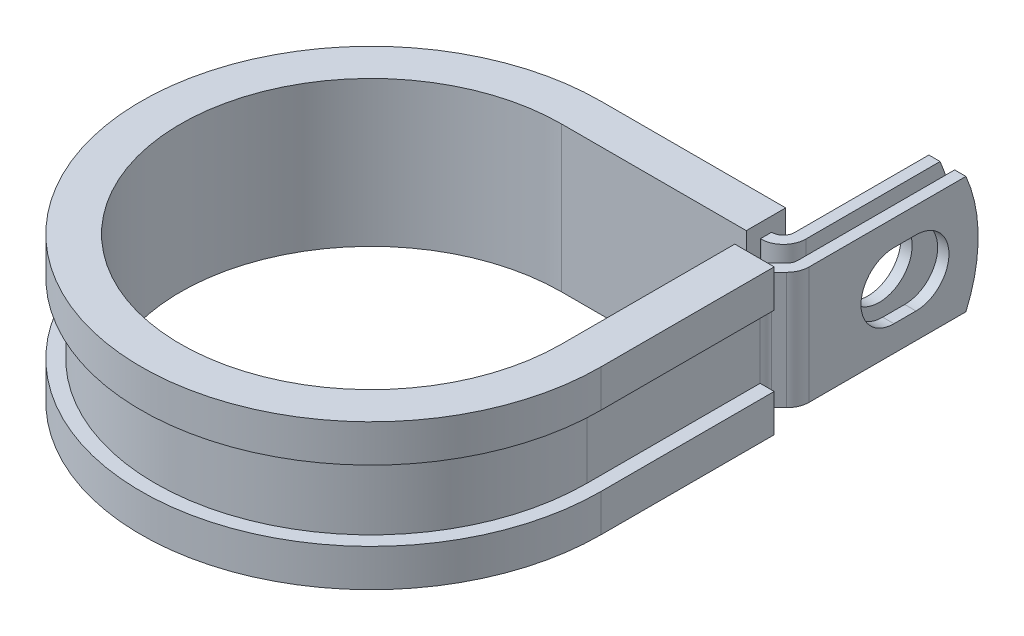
SolidWorks part; units mm, degrees
ref_plane "Front Plane" through (0, 0, 0) normal (0, 0, 1) x (1, 0, 0)
ref_plane "Top Plane" through (0, 0, 0) normal (0, 1, 0) x (1, 0, 0)
ref_plane "Right Plane" through (0, 0, 0) normal (1, 0, 0) x (0, 0, -1)
sketch "Sketch1" plane through (0, 0, 0) normal (0, 1, 0) x (1, 0, 0)
  line L0 (0, 22.1615) -> (20.0458, 22.1615)
  line L1 (22.1615, 0) -> (22.1615, 18.749)
  line L2 (22.4842, 40.4622) -> (22.4842, 24.5999)
  line L3 (22.8757, 20.4732) -> (23.7019, 21.2994)
  line L5 (24.059, 22.1615) -> (24.059, 40.4622)
  arc A0 (0, 22.1615) -> (22.1615, 0) centre (0, 0) ccw
  arc A1 (22.8757, 20.4732) -> (22.1615, 18.749) centre (24.5999, 18.749) ccw
  arc A2 (23.7019, 21.2994) -> (24.059, 22.1615) centre (22.8398, 22.1615) ccw
  arc A3 (20.0458, 22.1615) -> (22.4842, 24.5999) centre (20.0458, 24.5999) ccw
extrude "Extrude-Thin1" add sketch "Sketch1" along normal mid plane 12.7 thin
sketch "Sketch2" plane through (21.265, 0, 0) normal (-1, 0, 0) x (0, 0, 1)
  line L0 (-40.4622, 6.35) -> (-40.4622, -6.35) construction
  line L1 (0, 6.35) -> (0, -6.35) construction
  circle A0 centre (-32.5374, 0) radius 3.5687
  point P2 (-40.4622, 0)
extrude "Cut-Extrude1" cut sketch "Sketch2" against normal up to surface (1.2192 mm away)
sketch "Sketch3" plane through (25.2782, 0, 0) normal (1, 0, 0) x (0, 0, -1)
  line L0 (31.3436, 0) -> (33.7312, 0) construction
  line L1 (31.3436, 3.5687) -> (33.7312, 3.5687)
  line L2 (31.3436, -3.5687) -> (33.7312, -3.5687)
  line L3 (40.4622, 6.35) -> (40.4622, -6.35) construction
  arc A0 (31.3436, 3.5687) -> (31.3436, -3.5687) centre (31.3436, 0) ccw
  arc A1 (33.7312, -3.5687) -> (33.7312, 3.5687) centre (33.7312, 0) ccw
  point P3 (32.5374, 0)
  point P8 (40.4622, 0)
  point P11 (27.7749, 0)
  point P12 (37.2999, 0)
extrude "Cut-Extrude2" cut sketch "Sketch3" against normal up to surface (1.2192 mm away)
sketch "Sketch4" plane through (21.265, 0, 0) normal (-1, 0, 0) x (0, 0, 1)
  line L0 (-40.4622, 6.35) -> (-40.4622, -6.35)
  line L1 (-40.4622, 6.35) -> (-39.1369, 6.35)
  line L2 (-40.4622, 6.35) -> (-24.5999, 6.35) construction
  line L3 (-40.4622, -6.35) -> (-39.1369, -6.35)
  line L4 (-40.4622, -6.35) -> (-24.5999, -6.35) construction
  arc A0 (-39.1369, 6.35) -> (-39.1369, -6.35) centre (-24.5872, 0) ccw
extrude "Cut-Extrude3" cut sketch "Sketch4" against normal through all contours A0 M4 M5 | A0 L0 M2
ref_plane "Plane1" through (0, 0, -18.749) normal (0, 0, -1) x (-1, 0, 0)
ref_plane "Plane2" through (19.995, 0, 0) normal (-1, 0, 0) x (0, 0, 1)
sketch "Sketch5" plane through (0, 0, -18.749) normal (0, 0, -1) x (-1, 0, 0)
  line L0 (-23.3807, 6.35) -> (-22.1615, 6.35)
  line L1 (-23.3807, 6.35) -> (-23.3807, -6.35) construction
  line L3 (-22.1615, 6.35) -> (-22.1615, -6.35)
  line L4 (-22.1615, -6.35) -> (-23.3807, -6.35)
  line L5 (-23.3807, -6.35) -> (-23.3807, -3.81)
  line L6 (-23.3807, 6.35) -> (-23.3807, 3.81)
  line L7 (-24.9047, 7.874) -> (-24.9047, 3.81)
  line L8 (-24.9047, 7.874) -> (-20.6375, 7.874)
  line L9 (-20.6375, 7.874) -> (-20.6375, -7.874)
  line L10 (-20.6375, -7.874) -> (-24.9047, -7.874)
  line L11 (-24.9047, -7.874) -> (-24.9047, -3.81)
  line L12 (-24.9047, 3.81) -> (-23.3807, 3.81)
  line L13 (-23.3807, -3.81) -> (-24.9047, -3.81)
sketch "Sketch6" plane through (0, 6.35, 0) normal (0, 1, 0) x (1, 0, 0)
  line L0 (20.6375, 0) -> (20.6375, 18.749)
  line L1 (20.6375, 18.749) -> (24.9047, 18.749) construction
  line L2 (19.995, 6.9878) -> (19.995, -6.9878) construction
  line L5 (0, 20.6375) -> (19.995, 20.6375)
  arc A0 (0, 20.6375) -> (20.6375, 0) centre (0, 0) ccw
sweep "Sweep1" add profiles "Sketch5" path "Sketch6"
equation "\"D4@Sketch5\" = \"D1@Extrude-Thin1\""
equation "\"D5@Sketch5\" = \"D5@Extrude-Thin1\""
equation "\"D1@Sketch3\" = \"D2@Sketch2\""
equation "\"D7@Sketch1\" = \"D3@Sketch2\" + \"D1@Sketch3\""
equation "\"D1@Sketch1\" = \"D1@Sketch6\" + 2 * \"D3@Sketch5\""
equation "\"D1@Sketch4\" = ( \"D1@Extrude-Thin1\" + .125 ) * 2"
equation "\"D9@Sketch1\"= \"D5@Extrude-Thin1\""
equation "\"D8@Sketch1\"= 2 * \"D5@Extrude-Thin1\""
equation "\"D2@Sketch1\" = 2 * \"D5@Extrude-Thin1\""
equation "\"D2@Sketch3\" = \"D1@Sketch2\""
